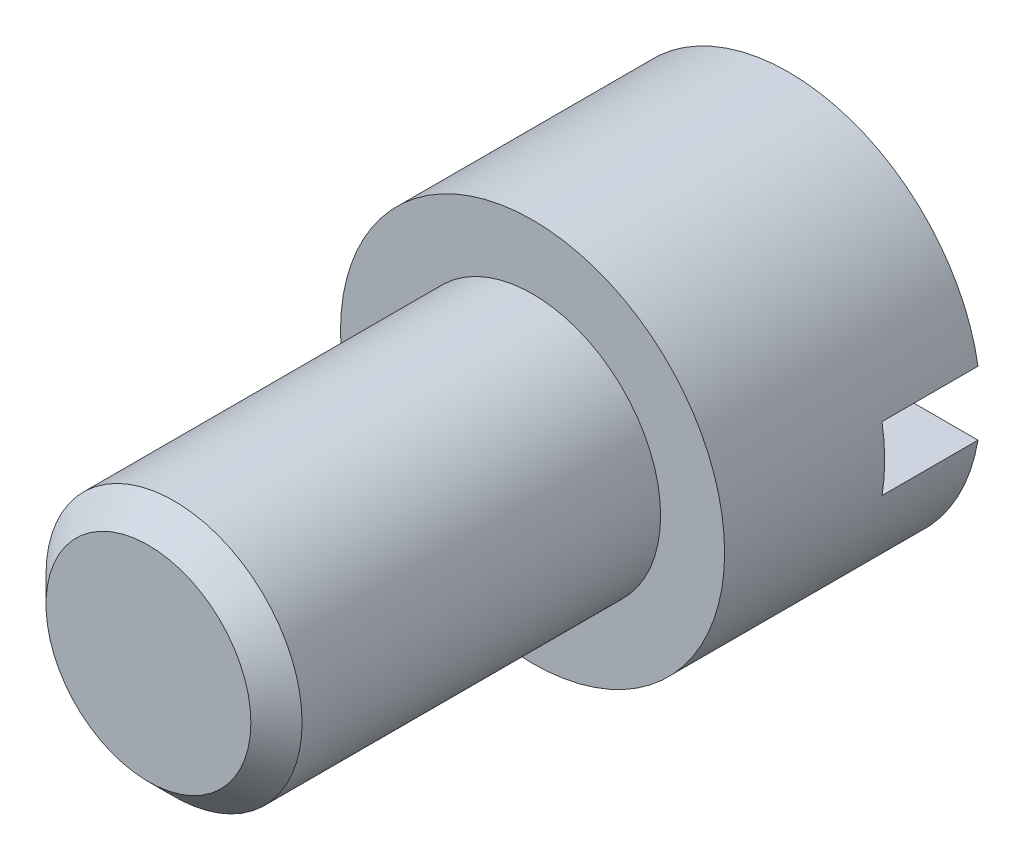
SolidWorks part; units mm, degrees
ref_plane "Plan de face" through (0, 0, 0) normal (0, 0, 1) x (1, 0, 0)
ref_plane "Plan de dessus" through (0, 0, 0) normal (0, 1, 0) x (1, 0, 0)
ref_plane "Plan de droite" through (0, 0, 0) normal (1, 0, 0) x (0, 0, -1)
sketch "Esquisse2" plane through (0, 0, 0) normal (0, 0, 1) x (1, 0, 0)
  circle A0 centre (0, 0) radius 1
  dimension "D1" = 2
extrude "Boss.-Extru.1" add sketch "Esquisse2" along normal blind 3
chamfer "Chanfrein1" distance 0.2 angle 45 1 edges at (1, 0, 3)
sketch "Esquisse3" plane through (0, 0, 0) normal (0, 0, -1) x (-1, 0, 0)
  circle A0 centre (0, 0) radius 1.5
  dimension "D1" = 3
extrude "Boss.-Extru.2" add sketch "Esquisse3" along normal blind 2
sketch "Esquisse6" plane through (0, 0, -2) normal (0, 0, -1) x (-1, 0, 0)
  line L0 (-1.7106, 0) -> (1.79, 0) construction
  line L2 (-2, 0.25) -> (2, 0.25)
  line L3 (-2, 0.25) -> (-2, -0.25)
  line L4 (-2, -0.25) -> (2, -0.25)
  line L5 (2, 0.25) -> (2, -0.25)
  dimension "D1" = 0.25
  dimension "D2" = 0.5
  dimension "D3" = 2
  dimension "D4" = 4
extrude "Enlèv. mat.-Extru.3" cut sketch "Esquisse6" against normal blind 0.75
